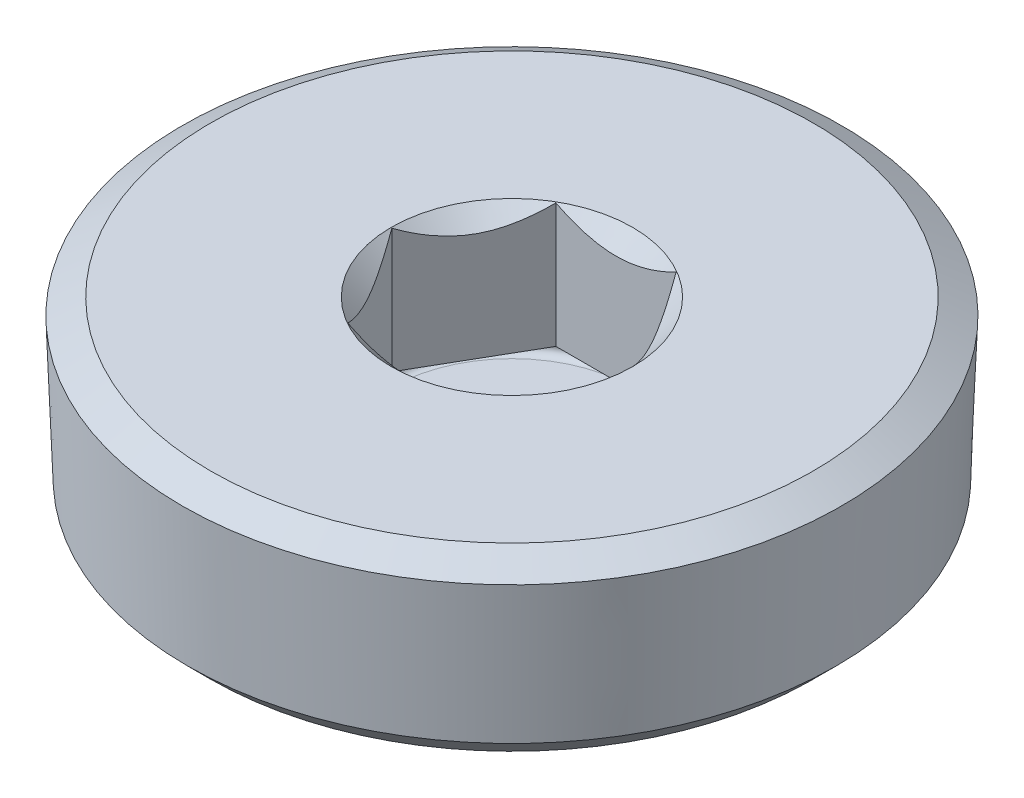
SolidWorks part; units mm, degrees
ref_plane "Front Plane" through (0, 0, 0) normal (0, 0, 1) x (1, 0, 0)
ref_plane "Top Plane" through (0, 0, 0) normal (0, 1, 0) x (1, 0, 0)
ref_plane "Right Plane" through (0, 0, 0) normal (1, 0, 0) x (0, 0, -1)
sketch "Sketch2" plane through (0, 0, 0) normal (0, 0, 1) x (1, 0, 0)
  line L0 (0, 10.7443) -> (0, -17.0657) construction
  line L1 (0, 0) -> (-27.5921, 0)
  line L2 (-30.1717, -1.4894) -> (-29.701, -14.4011)
  line L3 (-27.5921, -16.51) -> (0, -16.51)
  line L4 (0, -16.51) -> (0, 0)
  line L6 (-27.5921, -16.51) -> (-29.701, -14.4011)
  line L7 (-27.5921, 0) -> (-30.1717, -1.4894)
  point P4 (-30.226, 0)
  point P6 (-29.6241, -16.51)
  dimension "D1" = 16.51
  dimension "D2" = 2.088
  dimension "D3" = 60.452
  dimension "D4" = 30
  dimension "D5" = 2.032
  dimension "D6" = 45
revolve "Revolve1" add sketch "Sketch2" angle 360 about L0
sketch "Sketch3" plane through (0, 0, 0) normal (0, 0, 1) x (1, 0, 0)
  line L0 (0, 2.9342) -> (0, -18.7525) construction
  line L1 (0, 0) -> (-11.049, 0)
  line L2 (27.5921, 0) -> (-27.5921, 0) construction
  line L3 (-9.525, -1.524) -> (-9.525, -11.43)
  line L4 (-11.049, -12.7) -> (0, -12.7)
  line L5 (0, -12.7) -> (0, 0)
  line L6 (-9.525, -1.524) -> (-11.049, 0)
  line L7 (-9.525, -11.43) -> (-11.049, -11.43)
  arc A0 (-11.049, -11.43) -> (-11.049, -12.7) centre (-11.049, -12.065) ccw
  dimension "D1" = 11.43
  dimension "D2" = 12.7
  dimension "D3" = 19.05
  dimension "D4" = 1.524
  dimension "D5" = 45
  dimension "D6" = 1.524
revolve "Cut-Revolve1" cut sketch "Sketch3" angle 360 about L0
sketch "Sketch4" plane through (0, 0, 0) normal (0, 1, 0) x (1, 0, 0)
  line L1 (-5.4993, -9.525) -> (5.4993, -9.525)
  line L2 (5.4993, -9.525) -> (10.9985, 0)
  line L3 (10.9985, 0) -> (5.4993, 9.525)
  line L4 (5.4993, 9.525) -> (-5.4993, 9.525)
  line L5 (-5.4993, 9.525) -> (-10.9985, 0)
  line L6 (-10.9985, 0) -> (-5.4993, -9.525)
  circle A0 centre (0, 0) radius 9.525 construction
  circle A1 centre (0, 0) radius 9.525 construction
extrude "Cut-Extrude1" cut sketch "Sketch4" against normal up to vertex (5.2929 mm away)
